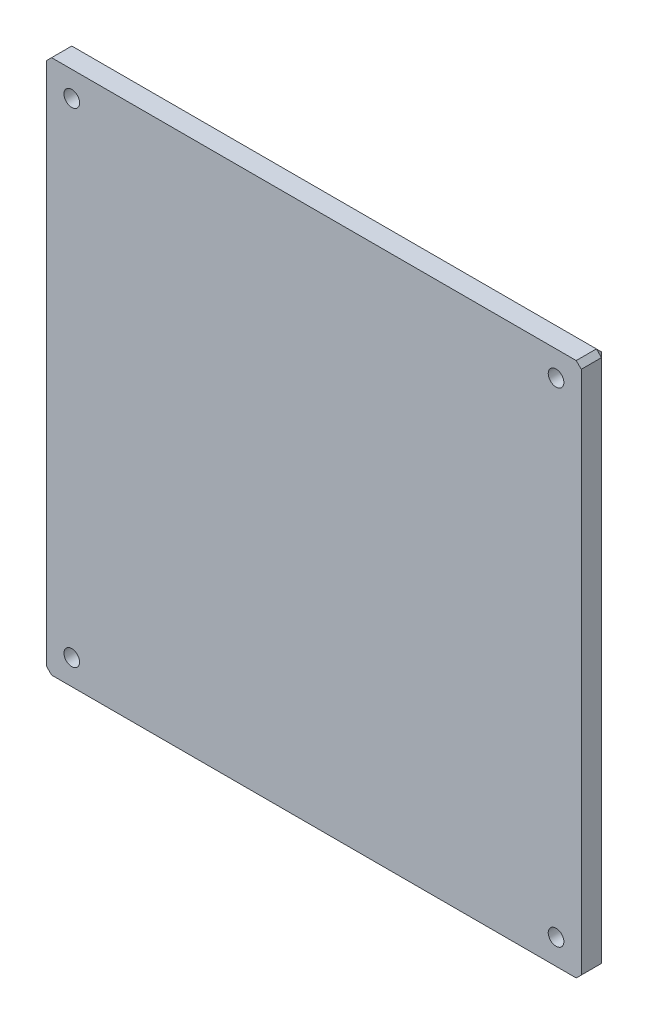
SolidWorks part; units mm, degrees
ref_plane "Front Plane" through (0, 0, 0) normal (0, 0, 1) x (1, 0, 0)
ref_plane "Top Plane" through (0, 0, 0) normal (0, 1, 0) x (1, 0, 0)
ref_plane "Right Plane" through (0, 0, 0) normal (1, 0, 0) x (0, 0, -1)
sketch "Sketch1" plane through (0, 0, 0) normal (0, 0, 1) x (1, 0, 0)
  line L1 (-53, 53) -> (53, 53)
  line L2 (-53, 53) -> (-53, -53)
  line L3 (-53, -53) -> (53, -53)
  line L4 (53, 53) -> (53, -53)
extrude "Boss-Extrude1" add sketch "Sketch1" along normal blind 5
sketch "Sketch2" plane through (0, 0, 0) normal (0, 0, 1) x (1, 0, 0)
  line L1 (-53, 53) -> (53, 53) construction
  line L2 (-53, 53) -> (-53, -53) construction
  line L3 (-53, -53) -> (53, -53) construction
  line L4 (53, 53) -> (53, -53) construction
  circle A0 centre (-48, 48) radius 1.55
  circle A1 centre (48, 48) radius 1.55
  circle A2 centre (-48, -48) radius 1.55
  circle A3 centre (48, -48) radius 1.55
  dimension "D1" = 5
  dimension "D3" = 3.1
  dimension "D6" = 3.1
  dimension "D9" = 3.1
  dimension "D12" = 3.1
  dimension "D2" = 5
  dimension "D4" = 5
  dimension "D5" = 5
  dimension "D7" = 5
  dimension "D8" = 5
  dimension "D10" = 5
  dimension "D11" = 5
extrude "Cut-Extrude1" cut sketch "Sketch2" along normal blind 10
chamfer "Chamfer2" distance 2 angle 45 1 edges at (49.55, 48, 0)
chamfer "Chamfer3" distance 2 angle 45 3 edges at (-46.45, 48, 0) (-46.45, -48, 0) (49.55, -48, 0)
chamfer "Chamfer4" distance 1 8 edges at (53, -53, 2.5) (0, -53, 0) (-53, -53, 2.5) (-53, 0, 0) (-53, 53, 2.5) (0, 53, 0) (53, 0, 0) (53, 53, 2.5)
